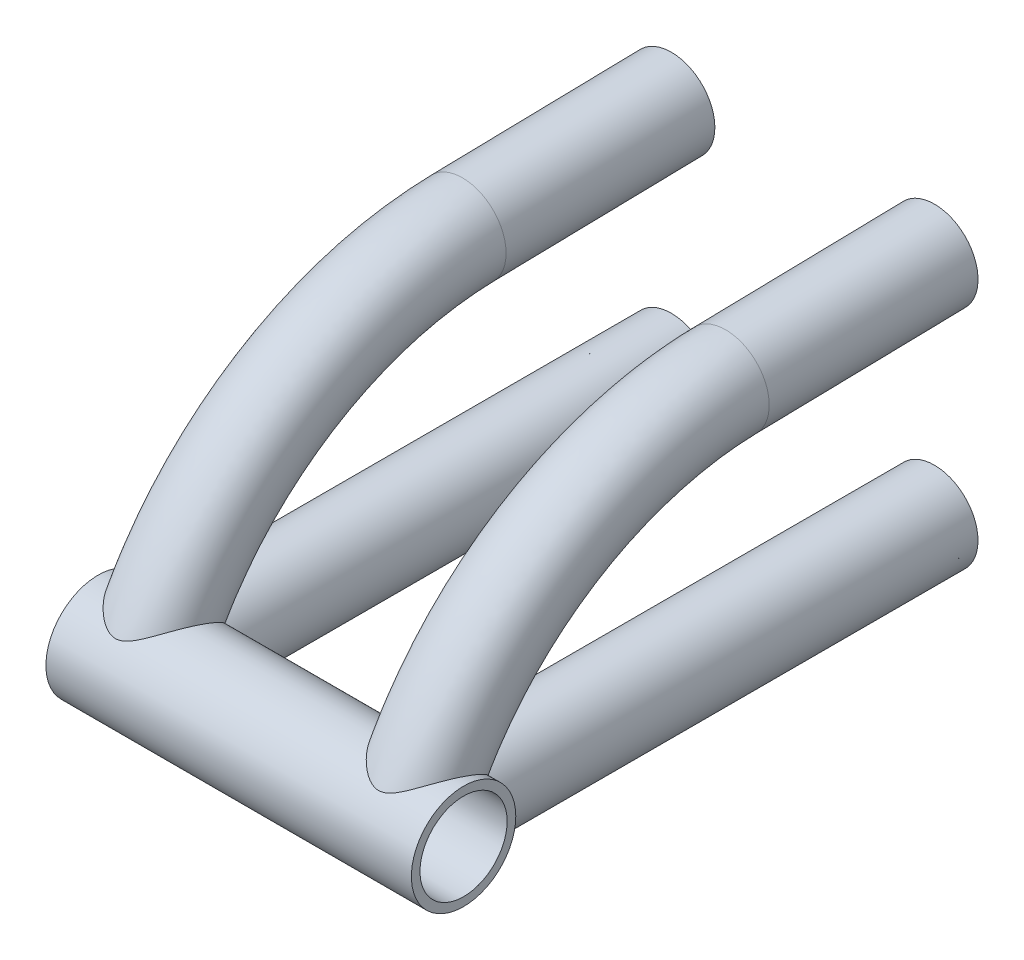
SolidWorks part; units mm, degrees
ref_plane "Front Plane" through (0, 0, 0) normal (0, 0, 1) x (1, 0, 0)
ref_plane "Top Plane" through (0, 0, 0) normal (0, 1, 0) x (1, 0, 0)
ref_plane "Right Plane" through (0, 0, 0) normal (1, 0, 0) x (0, 0, -1)
sketch "Sketch1" plane through (0, 0, 0) normal (0, 0, 1) x (1, 0, 0)
  line L0 (0, 0) -> (0, 16.4084) construction
  line L1 (0, 0) -> (15.2587, 0) construction
  circle A0 centre (0, 0) radius 3.175
  circle A1 centre (-24.003, -20.6248) radius 7.9375
  circle A2 centre (24.003, -20.6248) radius 7.9375
  circle A3 centre (-24.003, 20.6248) radius 7.9375
  circle A4 centre (24.003, 20.6248) radius 7.9375
  dimension "D1" = 6.35
  dimension "D2" = 15.875
  dimension "D3" = 48.006
  dimension "D4" = 20.6248
  dimension "D5" = 20.6248
sketch "Sketch2" plane through (0, 0, 0) normal (0, 0, 1) x (1, 0, 0)
  circle A0 centre (-24.003, -20.6248) radius 7.9375 construction
  circle A1 centre (24.003, -20.6248) radius 7.9375 construction
  circle A2 centre (-24.003, -20.6248) radius 7.9375
  circle A3 centre (24.003, -20.6248) radius 7.9375
extrude "Extrude-Thin1" add sketch "Sketch2" along normal blind 88.9 thin
ref_plane "Plane1" through (-24.003, 0, 0) normal (1, 0, 0) x (0, 0, -1)
sketch "Sketch3" plane through (-24.003, 0, 0) normal (1, 0, 0) x (0, 0, -1)
  line L0 (0, 20.6248) -> (-38.0913, 19.812)
  arc A0 (-38.0913, 19.812) -> (-95.2681, -19.05) centre (-36.7367, -43.6735) ccw
  dimension "D1" = 63.5
  dimension "D2" = 38.1
  dimension "D3" = 19.05
  dimension "D4" = 19.812
sketch "Sketch4" plane through (0, 0, 0) normal (0, 0, 1) x (1, 0, 0)
  circle A0 centre (-24.003, 20.6248) radius 7.9375 construction
  circle A1 centre (-24.003, 20.6248) radius 7.9375
sweep "Sweep-Thin1" add profiles "Sketch4" path "Sketch3" parameters "D1"=1.5748
sketch "Sketch5" plane through (0, 0, 0) normal (1, 0, 0) x (0, 0, -1)
  circle A0 centre (-95.25, -20.6248) radius 9.525
  dimension "D2" = 19.05
  dimension "D1" = 95.25
  dimension "D3" = 20.6248
sketch "Sketch6" plane through (0, 0, 0) normal (1, 0, 0) x (0, 0, -1)
  circle A0 centre (-95.25, -20.6248) radius 9.525 construction
  circle A1 centre (-95.25, -20.6248) radius 9.525
extrude "Cut-Extrude2" cut sketch "Sketch6" against normal mid plane 101.6
sketch "Sketch7" plane through (0, 0, 0) normal (1, 0, 0) x (0, 0, -1)
  circle A0 centre (-95.25, -20.6248) radius 9.525 construction
  circle A1 centre (-95.25, -20.6248) radius 9.525
extrude "Extrude-Thin3" add sketch "Sketch7" along normal mid plane 66.675 separate body thin
sketch "Sketch8" plane through (0, 0, 0) normal (0, 0, -1) x (-1, 0, 0)
  circle A0 centre (24.003, -20.6248) radius 7.9375 construction
  circle A1 centre (24.003, -20.6248) radius 7.9375
extrude "Cut-Extrude3" cut sketch "Sketch8" against normal blind 86.36
mirror "Mirror1" about plane through (0, 0, 0) normal (1, 0, 0)
